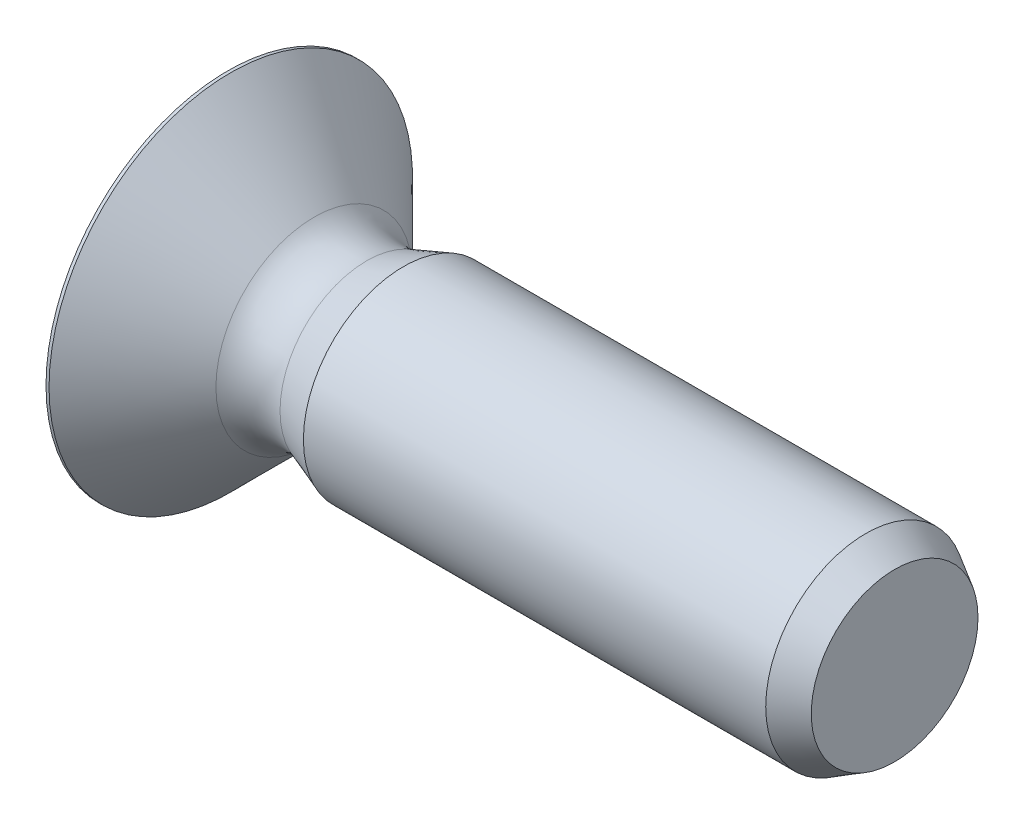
SolidWorks part; units mm, degrees
ref_plane "Front" through (0, 0, 0) normal (0, 0, 1) x (1, 0, 0)
ref_plane "Top" through (0, 0, 0) normal (0, 1, 0) x (1, 0, 0)
ref_plane "Right" through (0, 0, 0) normal (1, 0, 0) x (0, 0, -1)
other "Configuration Table"
sketch "Sketch1" plane through (0, 0, 0) normal (0, 0, 1) x (1, 0, 0)
  line L0 (-38.1054, 0) -> (11.3165, 0) construction
  line L1 (21.309, 0) -> (21.309, 3)
  line L2 (21.309, 3) -> (6.5779, 3)
  line L3 (6.5779, 3) -> (4.5779, 2.2721)
  line L4 (4.5779, 2.2721) -> (1.4, 5.45)
  line L5 (21.309, 0) -> (0, 0)
  line L6 (1.4, 5.45) -> (1.309, 5.45)
  line L7 (1.309, 5.45) -> (1.309, 0) construction
  arc A0 (1.309, 5.45) -> (0, 0) centre (12, 0) ccw
revolve "Base" add sketch "Sketch1" angle 360 about L0
sketch "Sketch2" plane through (0, 0, 0) normal (0, 1, 0) x (1, 0, 0)
  line L0 (22.6372, 0) -> (0, 0) construction
  line L1 (21.309, -3) -> (21.309, 3) construction
  line L2 (20.443, -3) -> (21.309, -2.5)
  line L6 (21.309, -2.5) -> (21.309, -3)
  line L7 (21.309, -3) -> (20.443, -3)
revolve "BaseEnd" cut sketch "Sketch2" angle 360 about L0
sketch "Sketch3" plane through (0, 0, 0) normal (-1, 0, 0) x (0, 0, 1)
  line L0 (0, 0) -> (-3.9695, 0) construction
  line L1 (0, 0) -> (0, 3.5828) construction
  line L2 (0.73, 3.65) -> (-0.73, 3.65)
  line L3 (-0.73, 3.65) -> (-0.73, 0.73)
  line L4 (-0.73, 0.73) -> (-3.65, 0.73)
  line L5 (-3.65, 0.73) -> (-3.65, -0.73)
  line L6 (-0.73, -0.73) -> (-3.65, -0.73)
  line L7 (-0.73, -3.65) -> (-0.73, -0.73)
  line L8 (0.73, -3.65) -> (-0.73, -3.65)
  line L9 (0.73, -3.65) -> (0.73, -0.73)
  line L10 (0.73, -0.73) -> (3.65, -0.73)
  line L11 (3.65, 0.73) -> (3.65, -0.73)
  line L12 (0.73, 0.73) -> (3.65, 0.73)
  line L13 (0.73, 3.65) -> (0.73, 0.73)
  point P4 (3.65, 0)
  point P10 (-3.65, 0)
  point P14 (0, -3.65)
  point P19 (0, 3.65)
extrude "CrossRecess" cut sketch "Sketch3" against normal blind 2.725
draft "Draft1" type of draft neutral plane draft angle 45 neutral plane "Right" faces to draft 4 parameters "D1"=45
fillet "Fillet1" radius 1.5 1 edges at (4.5779, 0, 2.2721)
sketch "Sketch6" plane through (0, 0, 0) normal (0, 1, 0) x (1, 0, 0)
  line L0 (0, 0) -> (23.9872, 0) construction
  line L1 (20.4359, 3.0141) -> (20.45, 3.0141)
  line L2 (20.45, 3.0141) -> (20.45, 3)
  line L3 (20.45, 3) -> (20.443, 2.9878)
  line L4 (20.443, 2.9878) -> (20.4359, 3)
  line L5 (20.4359, 3) -> (20.4359, 3.0141)
  line L6 (20.443, 3) -> (20.443, -3) construction
revolve "Cut-Revolve10" [suppressed] cut sketch "Sketch6" angle 360 about L0
pattern_linear "LPattern10" [suppressed] count 912 spacing 0.0183 along (1, 0, 0)
sketch "Sketch5" plane through (0, 0, 0) normal (0, 1, 0) x (1, 0, 0)
  line L0 (15.3245, 0) -> (-0.2214, 0) construction
  line L2 (3.8622, 2.9878) -> (10.1963, 2.9878)
  line L3 (10.1963, 2.9878) -> (11.4864, 3)
  line L5 (11.4864, 3) -> (3.85, 3)
  line L6 (3.85, 3) -> (3.8622, 2.9878)
  line L10 (21.309, -2.5) -> (21.309, 2.5) construction
  line L11 (1.4, -5.45) -> (1.4, 5.45) construction
revolve "Cut-Revolve2" [suppressed] cut sketch "Sketch5" angle 360 about L0
equation "\"D2@ThreadCosmetic1\" = \"d@Sketch1\" - 1"
equation "\"D2@Sketch2\" = \"D2@ThreadCosmetic1\""
equation "\"D3@Sketch2\" = \"d@Sketch1\""
equation "\"D2@Sketch3\" = \"m@Sketch3\" / 5"
equation "\"D1@Sketch5\" = \"d@Sketch1\" / 2 - \"a@Sketch1\" * tan ( 3.14 / 9 ) "
equation "\"D1@CrossRecess\" = \"dk@Sketch1\" /4"
equation "\"D1@Sketch6\" = \"d@Sketch1\""
equation "\"D2@Sketch6\" =  \"d@Sketch1\" / 2 - \"a@Sketch1\" * tan ( 3.14 / 9 ) "
equation "\"D3@LPattern10\" =  ( \"D1@Sketch6\" / 2 - \"D2@Sketch6\" )  * 1.5"
equation "\"D1@LPattern10\" =  ( \"l@Sketch1\" -  ( \"dk@Sketch1\" - \"d@Sketch1\" )  / 2 - (  \"D3@Sketch2\" - \"D2@Sketch2\" )  / 2 * 1.732 )  / \"D3@LPattern10\" - 1"
equation "\"D3@Sketch5\" = \"d@Sketch1\""
equation "\"D5@Sketch5\" =   \"dk@Sketch1\" / 2 - \"D1@Sketch5\""
